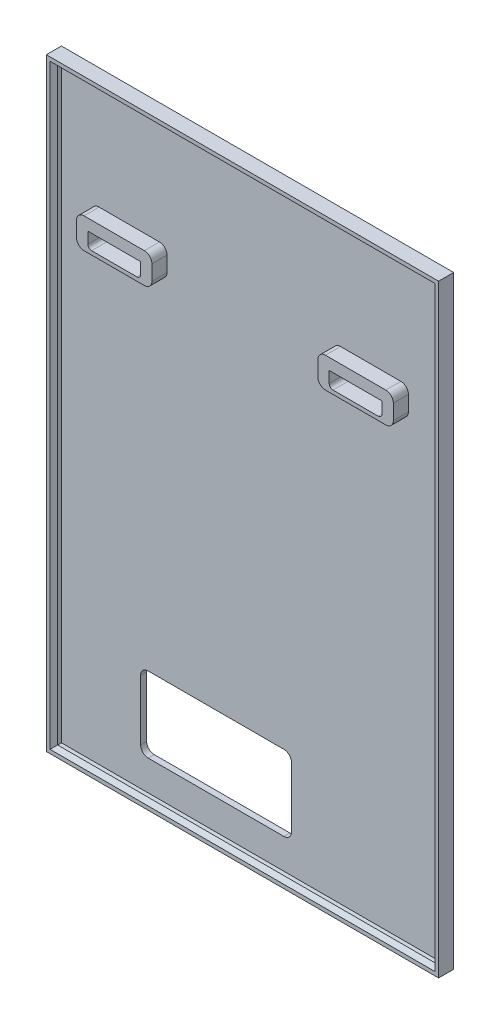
SolidWorks part; units mm, degrees
ref_plane "前基準面" through (0, 0, 0) normal (0, 0, 1) x (1, 0, 0)
ref_plane "上基準面" through (0, 0, 0) normal (0, 1, 0) x (1, 0, 0)
ref_plane "右基準面" through (0, 0, 0) normal (1, 0, 0) x (0, 0, -1)
sketch "草圖1" plane through (0, 0, 0) normal (0, 0, 1) x (1, 0, 0)
  line L1 (0, 0) -> (520, 0)
  line L2 (0, 0) -> (0, -800)
  line L3 (0, -800) -> (520, -800)
  line L4 (520, 0) -> (520, -800)
  dimension "D1" = 520
  dimension "D2" = 800
extrude "填料-伸長1" add sketch "草圖1" along normal blind 20
shell "薄殼2" thickness 10
shell "薄殼4" thickness 10
chamfer "導角1" distance 5 angle 45 4 edges at (260, -790, 20) (510, -400, 20) (10, -400, 20) (260, -10, 20)
sketch "草圖2" plane through (0, 0, 10) normal (0, 0, 1) x (1, 0, 0)
  line L0 (0, 0) -> (0, -800) construction
  line L1 (60, -150) -> (140, -150)
  line L2 (50, -160) -> (50, -180)
  line L3 (60, -190) -> (140, -190)
  line L4 (150, -160) -> (150, -180)
  line L5 (380, -150) -> (460, -150)
  line L6 (370, -160) -> (370, -180)
  line L7 (380, -190) -> (460, -190)
  line L8 (470, -160) -> (470, -180)
  line L9 (520, 0) -> (0, 0) construction
  line L10 (520, -800) -> (520, 0) construction
  line L11 (520, 0) -> (0, 0) construction
  arc A0 (150, -180) -> (140, -190) centre (140, -180) cw
  arc A1 (150, -160) -> (140, -150) centre (140, -160) ccw
  arc A2 (50, -180) -> (60, -190) centre (60, -180) ccw
  arc A3 (60, -150) -> (50, -160) centre (60, -160) ccw
  arc A4 (470, -180) -> (460, -190) centre (460, -180) cw
  arc A5 (470, -160) -> (460, -150) centre (460, -160) ccw
  arc A6 (370, -180) -> (380, -190) centre (380, -180) ccw
  arc A7 (370, -160) -> (380, -150) centre (380, -160) cw
  point P16 (150, -150)
  point P19 (50, -190)
  point P22 (50, -150)
  point P27 (470, -150)
  point P30 (370, -190)
  point P33 (370, -150)
  dimension "D8" = 10
  dimension "D9" = 10
  dimension "D1" = 100
  dimension "D2" = 100
  dimension "D3" = 40
  dimension "D4" = 40
  dimension "D5" = 50
  dimension "D6" = 50
  dimension "D7" = 150
  dimension "D10" = 150
extrude "填料-伸長2" add sketch "草圖2" along normal blind 20
sketch "草圖3" plane through (0, 0, 30) normal (0, 0, 1) x (1, 0, 0)
  line L0 (50, -160) -> (50, -180) construction
  line L1 (65, -165) -> (135, -165)
  line L2 (65, -165) -> (65, -180)
  line L3 (70, -185) -> (130, -185)
  line L4 (135, -165) -> (135, -180)
  line L5 (385, -165) -> (455, -165)
  line L6 (385, -165) -> (385, -180)
  line L7 (390, -185) -> (450, -185)
  line L8 (455, -165) -> (455, -180)
  line L9 (370, -160) -> (370, -180) construction
  line L10 (140, -150) -> (60, -150) construction
  line L11 (460, -150) -> (380, -150) construction
  arc A0 (455, -180) -> (450, -185) centre (450, -180) cw
  arc A1 (385, -180) -> (390, -185) centre (390, -180) ccw
  arc A2 (135, -180) -> (130, -185) centre (130, -180) cw
  arc A3 (65, -180) -> (70, -185) centre (70, -180) ccw
  point P21 (385, -185)
  point P26 (65, -185)
  dimension "D9" = 5
  dimension "D1" = 70
  dimension "D2" = 70
  dimension "D3" = 20
  dimension "D4" = 20
  dimension "D5" = 15
  dimension "D6" = 15
  dimension "D7" = 15
  dimension "D8" = 15
extrude "除料-伸長1" cut sketch "草圖3" against normal blind 20
sketch "草圖4" plane through (0, 0, 10) normal (0, 0, 1) x (1, 0, 0)
  line L0 (0, -800) -> (520, -800) construction
  line L1 (125, -650) -> (305, -650)
  line L2 (115, -660) -> (115, -740)
  line L3 (125, -750) -> (305, -750)
  line L4 (315, -660) -> (315, -740)
  line L5 (0, 0) -> (0, -800) construction
  arc A0 (305, -750) -> (315, -740) centre (305, -740) ccw
  arc A1 (115, -740) -> (125, -750) centre (125, -740) ccw
  arc A2 (305, -650) -> (315, -660) centre (305, -660) cw
  arc A3 (125, -650) -> (115, -660) centre (125, -660) ccw
  point P12 (115, -750)
  point P15 (315, -650)
  point P18 (115, -650)
  dimension "D5" = 10
  dimension "D1" = 200
  dimension "D2" = 100
  dimension "D3" = 50
  dimension "D4" = 115
extrude "除料-伸長2" cut sketch "草圖4" against normal through all
